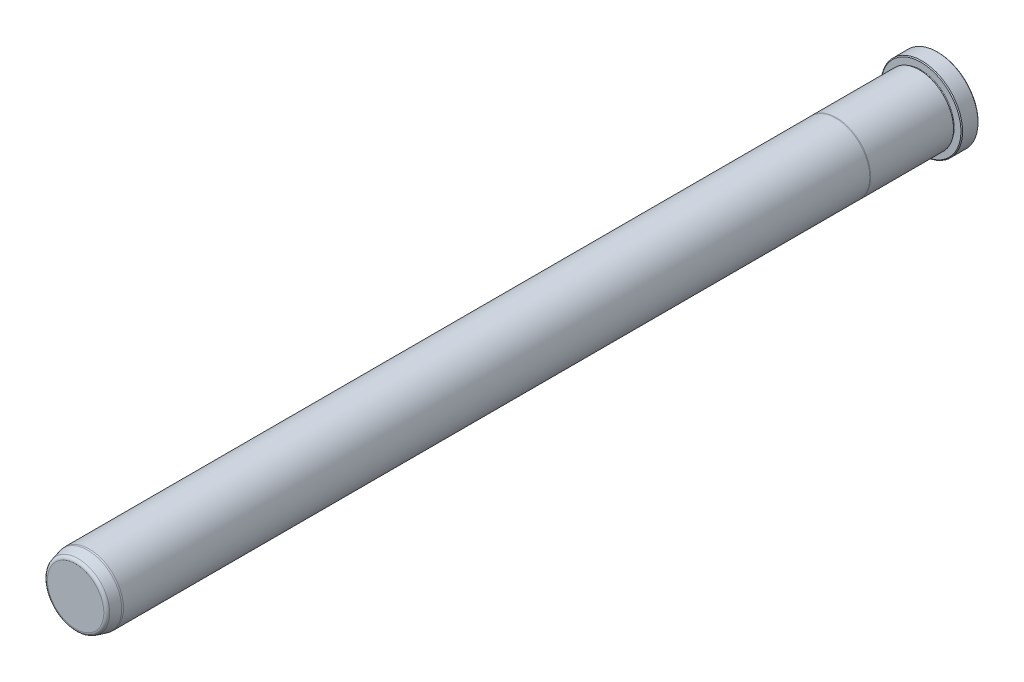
SolidWorks part; units mm, degrees
ref_plane "Front Plane" through (0, 0, 0) normal (0, 0, 1) x (1, 0, 0)
ref_plane "Top Plane" through (0, 0, 0) normal (0, 1, 0) x (1, 0, 0)
ref_plane "Right Plane" through (0, 0, 0) normal (1, 0, 0) x (0, 0, -1)
sketch "Sketch1" plane through (0, 0, 0) normal (1, 0, 0) x (0, 0, -1)
  line L0 (0, 0) -> (0, 18.923)
  line L1 (0, 18.923) -> (-7.9248, 18.923)
  line L2 (-7.9248, 18.923) -> (-7.9248, 15.4813)
  line L3 (-4.7498, 15.1003) -> (-5.5118, 15.1003) construction
  line L4 (-8.6868, 15.4813) -> (-8.6868, 15.8877)
  line L5 (-8.6868, 15.8877) -> (-47.1348, 15.8877)
  line L6 (-47.1348, 15.8877) -> (-47.498, 15.8623)
  line L7 (-47.498, 15.8623) -> (-393.7, 15.8623)
  line L9 (-400.05, 14.2983) -> (-400.05, 0)
  line L10 (-400.05, 0) -> (0, 0)
  line L11 (0, 0) -> (13.6287, 0) construction
  line L12 (-393.7, 15.8623) -> (-394.462, 15.7956)
  line L13 (-394.462, 15.7956) -> (-400.05, 14.2983)
  arc A0 (-8.6868, 15.4813) -> (-7.9248, 15.4813) centre (-8.3058, 15.4813) ccw
  dimension "D14" = 0.762
  dimension "D1" = 7.9248
  dimension "D2" = 0.762
  dimension "D3" = 37.846
  dimension "D4" = 31.7754
  dimension "D5" = 47.498
  dimension "D6" = 400.05
  dimension "D7" = 0.7874
  dimension "D8" = 4
  dimension "D9" = 31.7246
  dimension "D10" = 5
  dimension "D11" = 15
  dimension "D12" = 0.762
  dimension "D13" = 6.35
revolve "Revolve1" add sketch "Sketch1" angle 360 about L11
fillet "Fillet6" radius 1.5875 1 edges at (14.2983, 0, 400.05)
chamfer "Chamfer1" distance 0.381 angle 45 2 edges at (18.923, 0, 0) (18.923, 0, 7.9248)
